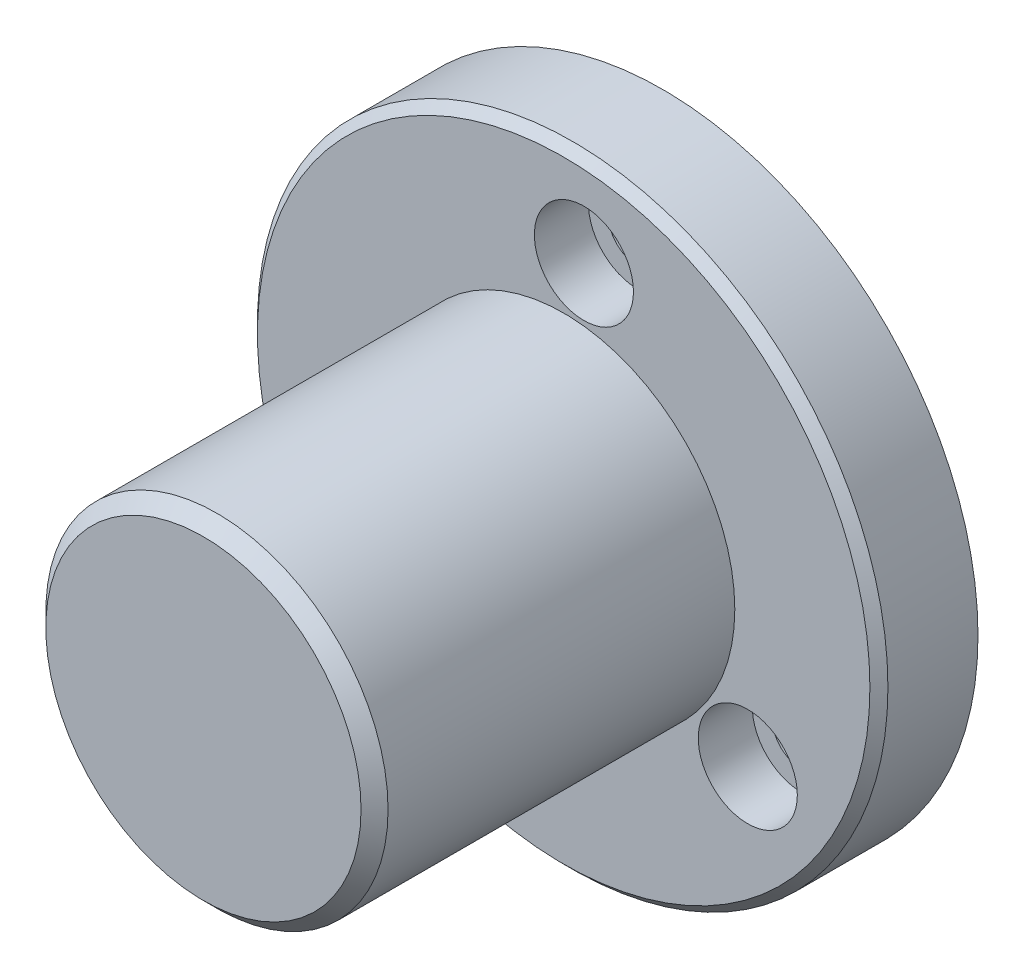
SolidWorks part; units mm, degrees
ref_plane "Plan de face" through (0, 0, 0) normal (0, 0, 1) x (1, 0, 0)
ref_plane "Plan de dessus" through (0, 0, 0) normal (0, 1, 0) x (1, 0, 0)
ref_plane "Plan de droite" through (0, 0, 0) normal (1, 0, 0) x (0, 0, -1)
sketch "Esquisse1" plane through (0, 0, 0) normal (0, 0, 1) x (1, 0, 0)
  circle A0 centre (0, 0) radius 35
  dimension "D1" = 70
extrude "Extrusion1" add sketch "Esquisse1" along normal blind 11
sketch "Esquisse2" plane through (0, 0, 11) normal (0, 0, 1) x (1, 0, 0)
  circle A0 centre (0, 0) radius 19
  circle A1 centre (0, 0) radius 35 construction
  dimension "D1" = 38
extrude "Extrusion2" add sketch "Esquisse2" along normal blind 40
chamfer "Chanfrein1" distance 1.5 angle 45 1 edges at (19, 0, 51)
chamfer "Chanfrein2" distance 1 angle 45 1 edges at (35, 0, 11)
hole_wizard "Chambrage pour vis à tête cylindrique à 6 pans creux (ou vis CHC) M61" positions "Esquisse4" profile "Esquisse3" counterbore size "M6" standard "Ansi Métrique"
sketch "Esquisse4" plane through (0, 0, 11) normal (0, 0, 1) x (1, 0, 0)
  line L0 (0, 0) -> (33.2041, -23.3828) construction
  line L1 (0, 0) -> (3.268, 36.2333) construction
  line L2 (0, 0) -> (-35.1436, -16.2731) construction
  circle A0 centre (0, 0) radius 25 construction
  point P0 (20.4403, -14.3943)
  point P1 (-22.686, -10.5046)
  point P3 (2.2457, 24.8989)
  dimension "D3" = 50
  dimension "D1" = 120
  dimension "D2" = 120
sketch "Esquisse3" plane through (20.4403, -14.3943, 11) normal (1, 0, 0) x (0, -1, 0)
  line L0 (0, 0) -> (0, 11)
  line L1 (0, 11) -> (3.3, 11)
  line L3 (3.3, 11) -> (3.3, 6)
  line L4 (3.3, 6) -> (5.5, 6)
  line L5 (5.5, 6) -> (5.5, 0)
  line L7 (5.5, 0) -> (0, 0)
  line L11 (0, -6.35) -> (0, 107.95) construction
  dimension "Diamètre du perçage jusqu'au prochain" = 6.6
  dimension "Profondeur du perçage jusqu'au prochain" = 11
  dimension "Diamètre du chambrage" = 11
  dimension "Profondeur du chambrage" = 6
